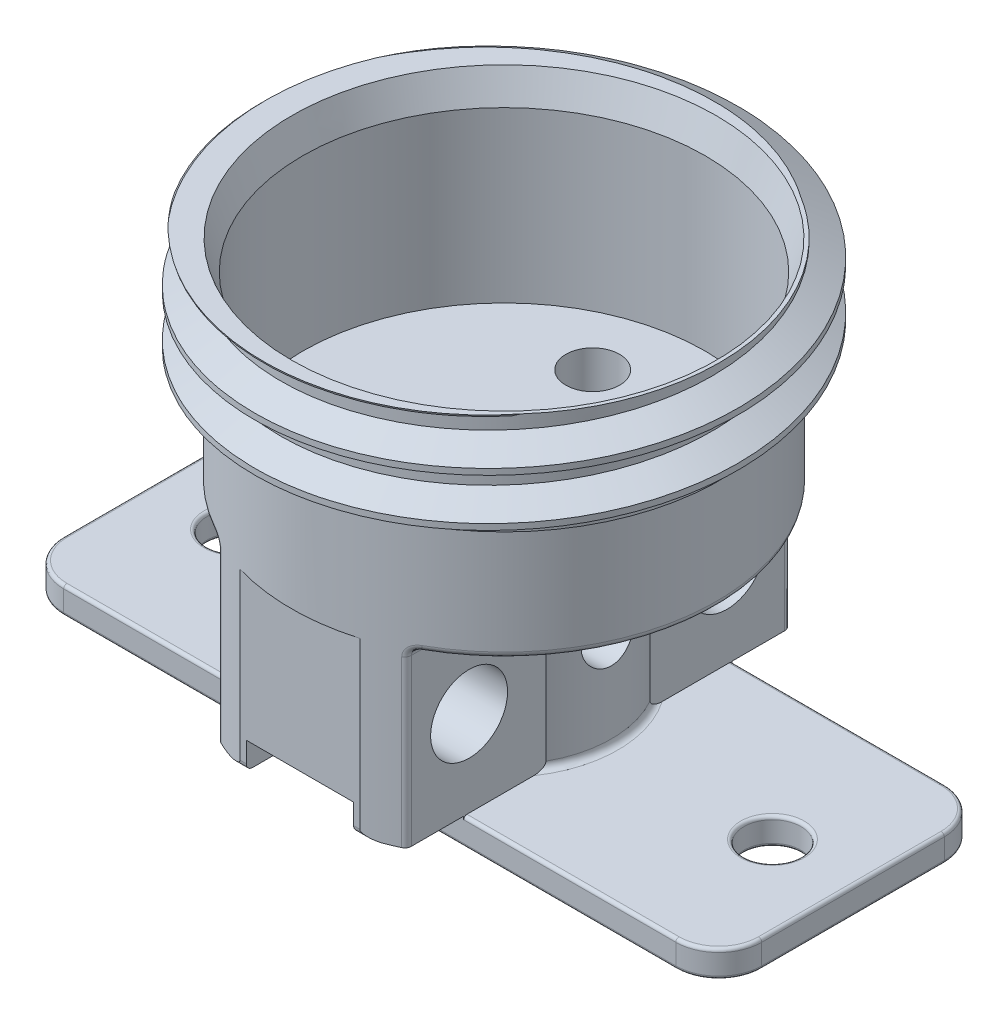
SolidWorks part; units mm, degrees
ref_plane "Front Plane" through (0, 0, 0) normal (0, 0, 1) x (1, 0, 0)
ref_plane "Top Plane" through (0, 0, 0) normal (0, 1, 0) x (1, 0, 0)
ref_plane "Right Plane" through (0, 0, 0) normal (1, 0, 0) x (0, 0, -1)
sketch "Sketch1" plane through (0, 0, 0) normal (0, 1, 0) x (1, 0, 0)
  line L1 (-36.195, 15.875) -> (36.195, 15.875)
  line L2 (-41.275, 10.795) -> (-41.275, -10.795)
  line L3 (-36.195, -15.875) -> (36.195, -15.875)
  line L4 (41.275, 10.795) -> (41.275, -10.795)
  arc A0 (36.195, -15.875) -> (41.275, -10.795) centre (36.195, -10.795) ccw
  arc A1 (36.195, 15.875) -> (41.275, 10.795) centre (36.195, 10.795) cw
  arc A2 (-36.195, 15.875) -> (-41.275, 10.795) centre (-36.195, 10.795) ccw
  arc A3 (-41.275, -10.795) -> (-36.195, -15.875) centre (-36.195, -10.795) ccw
  point P7 (41.275, -15.875)
  point P12 (-41.275, 15.875)
  point P15 (-41.275, -15.875)
  dimension "D5" = 5.08
  dimension "D1" = 31.75
  dimension "D2" = 15.875
  dimension "D3" = 82.55
  dimension "D4" = 41.275
extrude "mounting foot" add sketch "Sketch1" along normal blind 3.175
hole_wizard "1/4 Clearance Hole1" positions "Sketch7" profile "Sketch9" hole size "1/4" standard "ANSI Inch"
sketch "Sketch7" plane through (0, 3.175, 0) normal (0, 1, 0) x (1, 0, 0)
  line L0 (-41.275, 0) -> (41.275, 0) construction
  line L1 (-41.275, 10.795) -> (-41.275, -10.795) construction
  line L2 (41.275, -10.795) -> (41.275, 10.795) construction
  point P10 (-31.75, 0)
  point P12 (31.75, 0)
  dimension "D1" = 63.5
  dimension "D2" = 31.75
sketch "Sketch9" plane through (31.75, 3.175, 0) normal (1, 0, 0) x (0, 0, 1)
  line L0 (0, 0) -> (0, 3.175)
  line L1 (0, 3.175) -> (3.3782, 3.175)
  line L2 (3.3782, 3.175) -> (3.3782, 0)
  line L5 (3.3782, 0) -> (0, 0)
  line L11 (0, -6.35) -> (0, 107.95) construction
  dimension "Thru Hole Dia." = 6.7564
  dimension "Thru Hole Depth" = 3.175
sketch "Sketch2" plane through (0, 3.175, 0) normal (0, 1, 0) x (1, 0, 0)
  line L6 (-11.1125, 22.5573) -> (-11.1125, 6.1484)
  line L9 (-7.0756, -24.13) -> (7.0756, -24.13)
  line L12 (11.1125, 22.5573) -> (11.1125, 6.1484)
  line L13 (-11.1125, -6.1484) -> (-11.1125, -22.5573)
  line L14 (11.1125, -6.1484) -> (11.1125, -22.5573)
  line L15 (0, 24.13) -> (0, 0) construction
  line L16 (-7.0756, 24.13) -> (7.0756, 24.13)
  arc A14 (-11.1125, 6.1484) -> (-11.1125, -6.1484) centre (0, 0) ccw
  arc A15 (11.1125, -6.1484) -> (11.1125, 6.1484) centre (0, 0) ccw
  arc A16 (11.1125, 22.5573) -> (7.0756, 24.13) centre (0, 0) ccw
  arc A17 (-7.0756, 24.13) -> (-11.1125, 22.5573) centre (0, 0) ccw
  arc A18 (-11.1125, -22.5573) -> (-7.0756, -24.13) centre (0, 0) ccw
  arc A19 (7.0756, -24.13) -> (11.1125, -22.5573) centre (0, 0) ccw
  point P43 (11.1125, -24.13)
  point P46 (-11.1125, -24.13)
  dimension "D3" = 11.1125
  dimension "D6" = 50.292
  dimension "D2" = 12.7
  dimension "D1" = 22.225
  dimension "D5" = 24.13
  dimension "D7" = 24.13
extrude "ext block" add sketch "Sketch2" along normal blind 20.32
sketch "Sketch3" plane through (0, 23.495, 0) normal (0, 1, 0) x (1, 0, 0)
  circle A0 centre (0, 0) radius 28.575
  dimension "D1" = 57.15
extrude "cyl body" add sketch "Sketch3" along normal blind 25.4
sketch "Sketch4" plane through (0, 48.895, 0) normal (0, 1, 0) x (1, 0, 0)
  circle A0 centre (0, 0) radius 23.8125
  dimension "D1" = 47.625
extrude "cyl bore" cut sketch "Sketch4" against normal blind 23.495
sketch "Sketch5" plane through (0, 25.4, 0) normal (0, 1, 0) x (1, 0, 0)
  circle A0 centre (0, 0) radius 3.3782
  dimension "D1" = 6.7564
extrude "rod bore" cut sketch "Sketch5" against normal through all
sketch "Sketch24" plane through (0, 0, 0) normal (0, 0, 1) x (1, 0, 0)
  line L0 (3.3782, 0) -> (3.3782, 25.4) construction
  line L1 (3.3782, 23.495) -> (5.207, 23.495)
  line L2 (3.3782, 23.495) -> (3.3782, 20.32)
  line L3 (3.3782, 20.32) -> (5.207, 20.32)
  line L4 (5.461, 23.241) -> (5.461, 20.574)
  line L5 (0, 25.4) -> (0, 14.1317) construction
  line L6 (23.8125, 25.4) -> (-23.8125, 25.4) construction
  arc A0 (5.207, 20.32) -> (5.461, 20.574) centre (5.207, 20.574) ccw
  arc A1 (5.207, 23.495) -> (5.461, 23.241) centre (5.207, 23.241) cw
  point P13 (5.461, 20.32)
  point P16 (5.461, 23.495)
  dimension "D4" = 0.254
  dimension "D1" = 10.922
  dimension "D2" = 3.175
  dimension "D3" = 1.905
revolve "seal groove" cut sketch "Sketch24" angle 360 about L5
hole_wizard "1/8-27 NPSM Tapped Hole1" positions "Sketch20" profile "Sketch21" tap size "1/8-27 NPSM" standard "ANSI Inch"
sketch "Sketch20" plane through (11.1125, 0, 0) normal (1, 0, 0) x (0, 0, -1)
  line L0 (-28.3538, 13.335) -> (32.7878, 13.335) construction
  line L3 (-10.795, 3.175) -> (10.795, 3.175) construction
  point P7 (-15.24, 13.335)
  point P9 (15.24, 13.335)
  dimension "D1" = 10.16
  dimension "D2" = 15.24
  dimension "D3" = 15.24
sketch "Sketch21" plane through (11.1125, 13.335, -15.24) normal (0, 1, 0) x (0, 0, -1)
  line L0 (0, 0) -> (0, 15.8637)
  line L1 (0, 15.8637) -> (4.5466, 13.1318)
  line L2 (4.5466, 13.1318) -> (4.5466, 0)
  line L5 (4.5466, 0) -> (0, 0)
  line L10 (0, 15.8637) -> (-4.5466, 13.1318) construction
  line L11 (0, -6.35) -> (0, 107.95) construction
  dimension "Tap Drill Dia." = 9.0932
  dimension "Tap Drill Depth" = 13.1318
  dimension "Drill Angle" = 118
sketch "Sketch23" plane through (0, 25.4, 0) normal (0, 1, 0) x (1, 0, 0)
  circle A0 centre (-4.7512, 15.24) radius 3.175
  circle A1 centre (-4.7512, -15.24) radius 3.175
  dimension "D1" = 6.35
  dimension "D2" = 6.35
extrude "fluid paths" cut sketch "Sketch23" against normal blind 16.51
thread "Thread1" pitch 5.6444 start angle 0, offset 5.08, length 0, pitch 5.6444, diameter 57.15
ref_plane "Plane1" through (-28.575, 53.975, 0) normal (0, 0, 1) x (-1, 0, 0)
sketch "Thread Profile1" plane through (-28.575, 53.975, 0) normal (0, 0, 1) x (-1, 0, 0)
  line L0 (0, 0) -> (0, 5.6444) construction
  line L11 (0, 0) -> (0, 4.9389)
  line L12 (0, 4.9389) -> (-3.0551, 3.175)
  line L13 (-3.0551, 3.175) -> (-3.0551, 1.7639)
  line L15 (-3.0551, 1.7639) -> (0, 0)
  line L17 (-3.0551, 2.4694) -> (0, 2.4694) construction
  point P2 (0, 0)
  dimension "Pitch" = 5.6444
  dimension "Profile_Angle" = 60
  dimension "Profile_Land" = 1.4111
  dimension "Profile_Height" = 3.0551
sketch "Sketch19" plane through (0, 23.495, 0) normal (0, -1, 0) x (1, 0, 0)
  circle A0 centre (0, 0) radius 28.575 construction
  circle A1 centre (0, 0) radius 28.575
  circle A3 centre (0, 0) radius 25.146
  dimension "D1" = 50.292
extrude "cyl lower weight reduction" cut sketch "Sketch19" against normal blind 13.335
chamfer "Chamfer1" distance 0.381 angle 45 3 edges at (-0.2391, 48.895, 27.1213) (-27.786, 48.895, 6.6686) (13.393, 36.83, -23.3382)
chamfer "Chamfer2" distance 1.27 angle 70 1 edges at (0, 48.895, 23.8125)
fillet "Fillet5" radius 0.762 12 edges at (11.1125, 13.335, -22.5573) (11.1125, 13.335, 22.5573) (-11.1125, 13.335, 22.5573) (-11.1125, 13.335, -22.5573) (11.1125, 23.495, -14.3529) (12.7, 23.495, 0) (11.1125, 23.495, 14.3529) (25.146, 23.495, 0) (-11.1125, 23.495, 14.3529) (-12.7, 23.495, 0) (-11.1125, 23.495, -14.3529) (-25.146, 23.495, 0)
fillet "Fillet6" radius 0.762 4 edges at (0, 3.175, -24.13) (0, 3.175, 24.13) (12.7, 3.175, 0) (-12.7, 3.175, 0)
sketch "Sketch26" plane through (0, 0, 0) normal (0, -1, 0) x (1, 0, 0)
  line L0 (-6.35, -9.1195) -> (-6.35, -24.13)
  line L2 (-6.35, 24.13) -> (-6.35, 9.1195)
  line L4 (6.35, 24.13) -> (6.35, 9.1195)
  line L5 (6.35, -9.1195) -> (6.35, -24.13)
  line L6 (-6.35, 24.13) -> (6.35, 24.13)
  line L8 (-6.35, -24.13) -> (6.35, -24.13)
  line L10 (-7.0756, 24.13) -> (7.0756, 24.13) construction
  line L11 (7.0756, -24.13) -> (-7.0756, -24.13) construction
  arc A0 (-6.35, 9.1195) -> (-6.35, -9.1195) centre (0, 0) ccw
  arc A1 (6.35, -9.1195) -> (6.35, 9.1195) centre (0, 0) ccw
  point P17 (6.985, -25.4)
  point P22 (6.985, 25.4)
  dimension "D3" = 22.225
  dimension "D1" = 6.35
  dimension "D2" = 6.35
extrude "vent channel" cut sketch "Sketch26" against normal blind 6.35
sketch "Sketch28" plane through (0, 0, 0) normal (0, -1, 0) x (1, 0, 0)
  circle A0 centre (0, 0) radius 8.0645
  dimension "D1" = 16.129
extrude "plunger cbore" cut sketch "Sketch28" against normal blind 17.78
sketch "Sketch29" plane through (0, 0, 0) normal (1, 0, 0) x (0, 0, -1)
  line L0 (0, 0) -> (0, 30.5582) construction
  line L1 (-8.0645, 17.78) -> (8.0645, 17.78) construction
  circle A0 centre (0, 14.605) radius 3.175
  dimension "D1" = 6.35
extrude "vent" cut sketch "Sketch29" against normal through all and the other way through all
fillet "Fillet9" radius 0.381 38 edges at (23.6537, 3.175, -15.875) (39.7871, 3.175, -14.3871) (41.275, 3.175, 0) (39.7871, 3.175, 14.3871) (-23.6537, 3.175, -15.875) (-39.7871, 3.175, -14.3871) (-41.275, 3.175, 0) (-39.7871, 3.175, 14.3871) (39.7871, 0, 14.3871) (41.275, 0, 0) (39.7871, 0, -14.3871) (21.2725, 0, -15.875) (6.35, 0, -12.4972) (11.1125, 0, 0) (6.35, 0, 12.4972) (21.2725, 0, 15.875) (31.75, 0, 3.3782) (-39.7871, 0, -14.3871) (-41.275, 0, 0) (-39.7871, 0, 14.3871) (-21.2725, 0, 15.875) (-6.35, 0, 12.4972) (-11.1125, 0, 0) (-6.35, 0, -12.4972) (-21.2725, 0, -15.875) (-31.75, 0, 3.3782) (31.75, 3.175, 3.3782) (-31.75, 3.175, 3.3782) (23.6538, 3.175, 15.875) (-23.6537, 3.175, 15.875) (6.35, 3.175, -9.1195) (6.35, 3.175, 9.1195) (-6.35, 3.175, 9.1195) (-6.35, 1.5875, -15.875) (-6.35, 3.175, -9.1195) (6.35, 1.5875, 15.875) (-6.35, 1.5875, 15.875) (0, 6.35, -8.0645)
